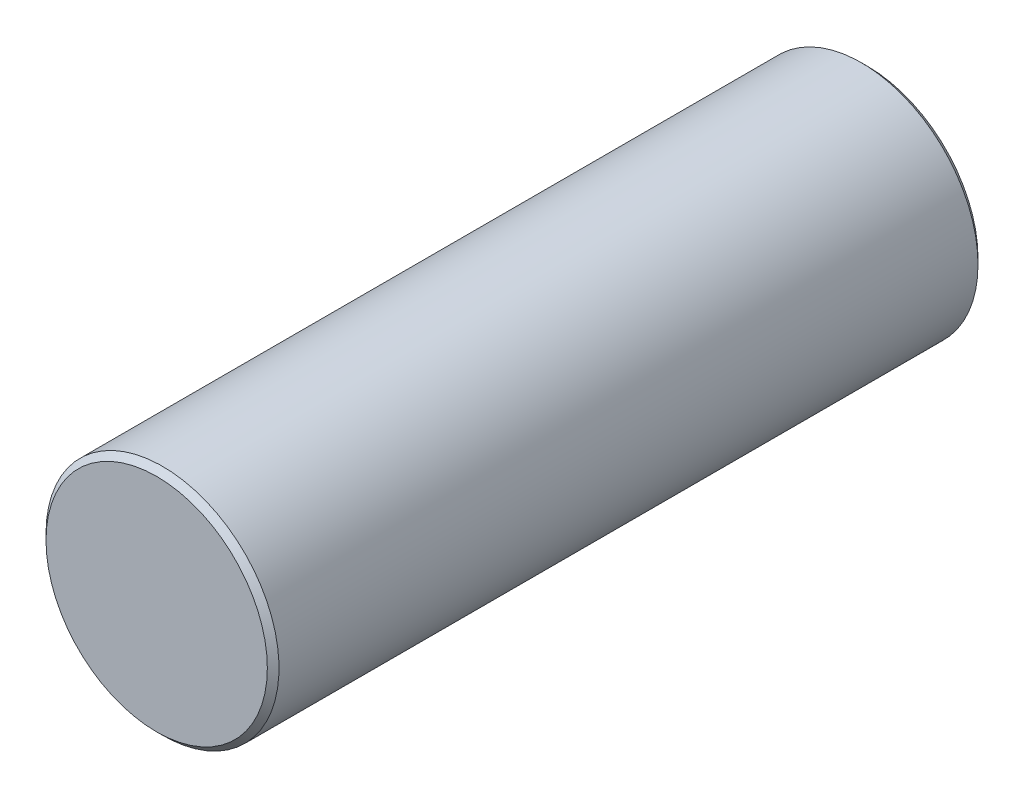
SolidWorks part; units mm, degrees
ref_plane "Спереди" through (0, 0, 0) normal (0, 0, 1) x (1, 0, 0)
ref_plane "Сверху" through (0, 0, 0) normal (0, 1, 0) x (1, 0, 0)
ref_plane "Справа" through (0, 0, 0) normal (1, 0, 0) x (0, 0, -1)
sketch "Эскиз1" plane through (0, 0, 0) normal (0, 0, 1) x (1, 0, 0)
  circle A0 centre (0, 0) radius 10
  dimension "D1" = 20
extrude "Бобышка-Вытянуть1" add sketch "Эскиз1" along normal mid plane 61
chamfer "Фаска1" distance 0.5 angle 45 2 edges at (10, 0, -30.5) (10, 0, 30.5)
